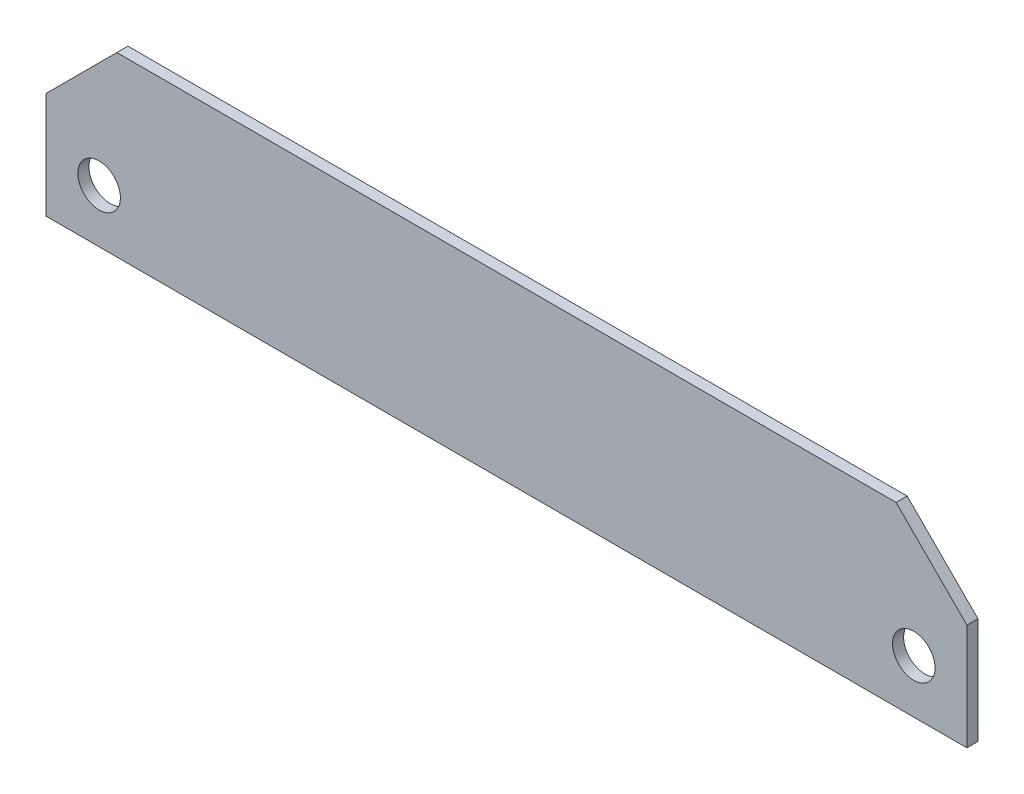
SolidWorks part; units mm, degrees
ref_plane "Front Plane" through (0, 0, 0) normal (0, 0, 1) x (1, 0, 0)
ref_plane "Top Plane" through (0, 0, 0) normal (0, 1, 0) x (1, 0, 0)
ref_plane "Right Plane" through (0, 0, 0) normal (1, 0, 0) x (0, 0, -1)
sketch "Sketch1" plane through (0, 0, 0) normal (0, 0, 1) x (1, 0, 0)
  line L1 (0, 0) -> (66.04, 0)
  line L2 (0, 0) -> (0, 12.7)
  line L3 (0, 12.7) -> (66.04, 12.7)
  line L4 (66.04, 0) -> (66.04, 12.7)
  dimension "D1" = 66.04
  dimension "D2" = 12.7
extrude "Extrude1" add sketch "Sketch1" along normal blind 0.7937
sketch "Sketch2" plane through (0, 0, 0.7937) normal (0, 0, 1) x (1, 0, 0)
  line L0 (33.02, 12.7) -> (33.02, 0) construction
  line L1 (66.04, 12.7) -> (0, 12.7) construction
  line L2 (0, 0) -> (66.04, 0) construction
  line L3 (0, 12.7) -> (0, 0) construction
  circle A0 centre (3.81, 3.81) radius 1.524
  circle A1 centre (62.23, 3.81) radius 1.524
  dimension "D1" = 3.048
  dimension "D2" = 3.81
  dimension "D3" = 8.89
extrude "Cut-Extrude1" cut sketch "Sketch2" against normal through all
chamfer "Chamfer1" distance 5.08 angle 45 2 edges at (66.04, 12.7, 0.3969) (0, 12.7, 0.3969)
